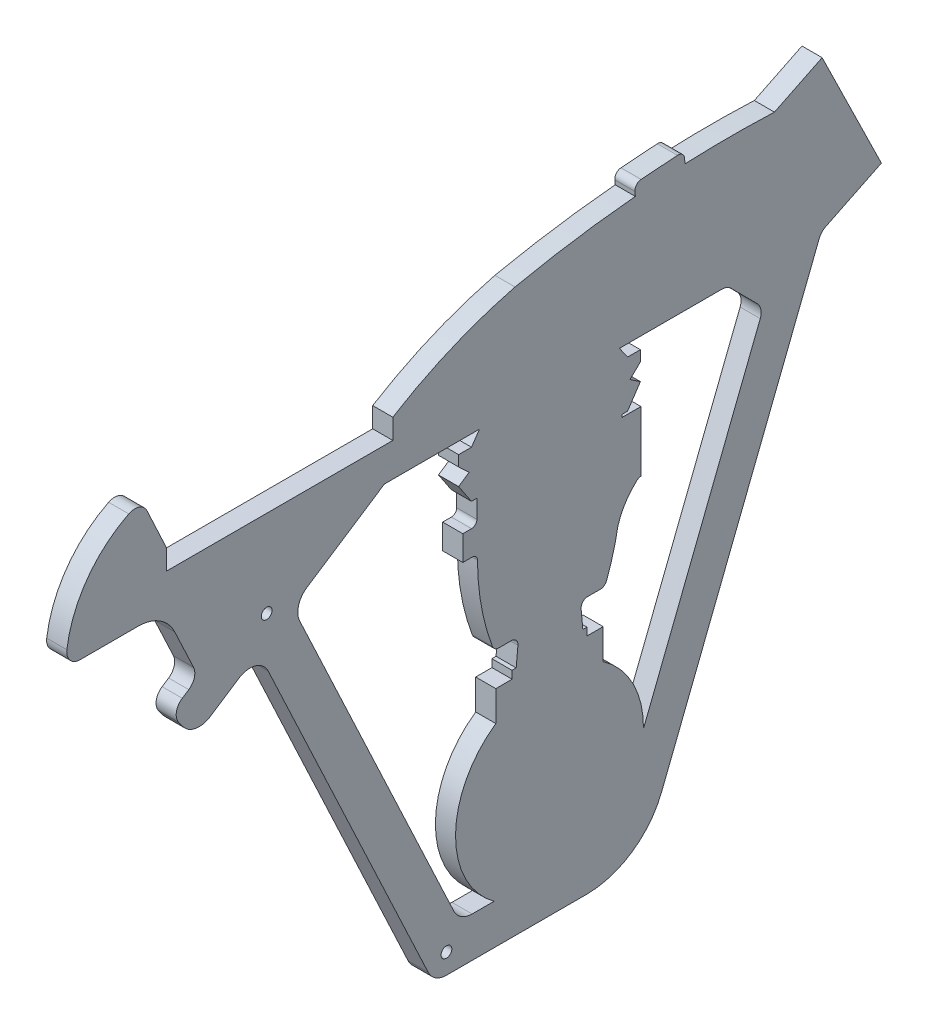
SolidWorks part; units mm, degrees
ref_plane "Alzado" through (0, 0, 0) normal (0, 0, 1) x (1, 0, 0)
ref_plane "Planta" through (0, 0, 0) normal (0, 1, 0) x (1, 0, 0)
ref_plane "Vista lateral" through (0, 0, 0) normal (1, 0, 0) x (0, 0, -1)
sketch "Croquis1" plane through (0, 0, 0) normal (1, 0, 0) x (0, 0, -1)
  line L0 (13667.9983, 5369.9869) -> (13690.858, 5384.9869)
  line L1 (13615.9773, 5299.97) -> (13684.5821, 5344.9869)
  line L2 (13615.9773, 5299.97) -> (13740.3667, 5034.9869)
  line L3 (13667.6771, 5119.2363) -> (13721.3084, 5004.9869)
  line L4 (13721.3084, 5004.9869) -> (13754.4494, 5004.9869)
  line L5 (13577.2438, 5124.9869) -> (13658.6248, 5124.9869)
  line L6 (13524.9162, 5369.9869) -> (13667.9983, 5369.9869)
  line L7 (13522.2981, 5384.9869) -> (13522.2981, 5369.9869)
  line L8 (13524.9162, 5369.9869) -> (13522.2981, 5369.9869)
  line L9 (13447.2981, 5344.9869) -> (13501.2421, 5344.9869)
  line L10 (13522.2981, 5384.9869) -> (13503.6357, 5425.0086)
  line L11 (13524.9215, 5276.1032) -> (13546.1095, 5290.0063)
  line L12 (13942.9288, 5342.0265) -> (13962.3593, 5322.4223)
  line L13 (14008.4696, 5341.3669) -> (13891.049, 5043.0137)
  line L14 (13964.5621, 5311.7205) -> (13877.5726, 5090.6894)
  line L15 (13754.4494, 5004.9869) -> (13835.2174, 5004.9869)
  line L16 (13740.3667, 5034.9869) -> (13766.3054, 5034.9869)
  line L17 (13684.5821, 5344.9869) -> (13755.4522, 5344.9869)
  line L18 (13859.703, 5344.9869) -> (13935.8264, 5344.9869)
  line L19 (13528.3988, 5327.735) -> (13546.1095, 5290.0063)
  line L20 (13875.8064, 5445.9012) -> (13902.9105, 5447.8818)
  line L21 (13975.13, 5439.6545) -> (14037.5829, 5470.2464)
  line L22 (14037.5829, 5470.2464) -> (14081.7674, 5380.0446)
  line L23 (14081.7674, 5380.0446) -> (14013.3909, 5346.6925)
  line L24 (13871.1919, 5440.4559) -> (13871.5029, 5437.0801)
  line L25 (13908.27, 5443.1152) -> (13908.4253, 5439.5925)
  line L26 (13847.5776, 5171.5255) -> (13835.4535, 5171.5255)
  line L27 (13779.7017, 5171.5255) -> (13767.5776, 5171.5255)
  line L28 (13767.5776, 5171.5255) -> (13767.5776, 5148.9711)
  line L29 (13847.5776, 5171.5255) -> (13847.5776, 5148.9711)
  line L30 (13743.0012, 5283.7615) -> (13749.4823, 5283.7615)
  line L31 (13753.4823, 5287.7615) -> (13753.4823, 5301.4231)
  line L32 (13749.4361, 5301.4231) -> (13739.8671, 5315.7235)
  line L33 (13739.8671, 5315.7235) -> (13747.684, 5320.9768)
  line L34 (13747.684, 5320.9768) -> (13739.8671, 5328.3853)
  line L35 (13739.8671, 5328.3853) -> (13739.8671, 5336.3326)
  line L36 (13739.8671, 5336.3326) -> (13749.4361, 5336.3326)
  line L37 (13779.0681, 5196.6733) -> (13769.771, 5196.6733)
  line L38 (13741.3273, 5336.3326) -> (13749.4361, 5336.3326)
  line L39 (13749.4361, 5336.3326) -> (13755.4522, 5344.9869)
  line L40 (13749.4361, 5301.4231) -> (13753.4823, 5301.4231)
  line L41 (13832.4116, 5177.3224) -> (13835.4535, 5177.259)
  line L42 (13835.4535, 5177.259) -> (13835.4535, 5171.5255)
  line L43 (13784.0462, 5191.2063) -> (13782.7436, 5177.3224)
  line L44 (13782.7436, 5177.3224) -> (13779.7017, 5177.259)
  line L45 (13779.7017, 5177.259) -> (13779.7017, 5171.5255)
  line L46 (13743.0012, 5265.1728) -> (13749.9204, 5265.1728)
  line L47 (13836.0871, 5196.6733) -> (13845.3843, 5196.6733)
  line L48 (13831.109, 5191.2063) -> (13832.4116, 5177.3224)
  line L49 (13861.673, 5294.4672) -> (13890.326, 5294.4672)
  line L50 (13875.9312, 5254.4672) -> (13890.326, 5254.4672)
  line L51 (13861.673, 5294.4672) -> (13861.673, 5301.4231)
  line L52 (13865.7191, 5301.4231) -> (13875.2881, 5315.7235)
  line L53 (13875.2881, 5315.7235) -> (13867.4712, 5320.9768)
  line L54 (13867.4712, 5320.9768) -> (13875.2881, 5328.3853)
  line L55 (13875.2881, 5328.3853) -> (13875.2881, 5336.3326)
  line L56 (13875.2881, 5336.3326) -> (13865.7191, 5336.3326)
  line L57 (13873.8279, 5336.3326) -> (13865.7191, 5336.3326)
  line L58 (13865.7191, 5336.3326) -> (13859.703, 5344.9869)
  line L59 (13865.7191, 5301.4231) -> (13861.673, 5301.4231)
  line L60 (13743.0012, 5283.7615) -> (13743.0012, 5265.1728)
  arc A0 (13667.6771, 5119.2363) -> (13658.6248, 5124.9869) centre (13658.6248, 5114.9869) ccw
  arc A1 (13577.2438, 5124.9869) -> (13524.9215, 5276.1032) centre (13347.2981, 5129.9869) ccw
  arc A2 (13503.6357, 5425.0086) -> (13447.2981, 5344.9869) centre (13532.2981, 5344.9869) ccw
  arc A3 (13942.9288, 5342.0265) -> (13935.8264, 5344.9869) centre (13935.8264, 5334.9869) ccw
  arc A4 (14013.3909, 5346.6925) -> (14008.4696, 5341.3669) centre (14017.7749, 5337.7047) ccw
  arc A5 (13964.5621, 5311.7205) -> (13962.3593, 5322.4223) centre (13955.2569, 5315.3828) ccw
  arc A6 (13835.2174, 5004.9869) -> (13891.049, 5043.0137) centre (13835.2174, 5064.9869) ccw
  arc A7 (13528.3988, 5327.735) -> (13501.2421, 5344.9869) centre (13501.2421, 5314.9869) ccw
  arc A8 (13781.8639, 5423.4908) -> (13690.858, 5384.9869) centre (13862.0741, 5107.1094) ccw
  arc A9 (13975.13, 5439.6545) -> (13908.4253, 5439.5925) centre (13942.4955, 4666.352) ccw
  arc A10 (13871.5029, 5437.0801) -> (13781.8639, 5423.4908) centre (13942.4955, 4666.352) ccw
  arc A11 (13875.8064, 5445.9012) -> (13871.1919, 5440.4559) centre (13876.1708, 5440.9145) ccw
  arc A12 (13908.27, 5443.1152) -> (13902.9105, 5447.8818) centre (13903.2749, 5442.8951) ccw
  arc A13 (13767.5776, 5148.9711) -> (13766.3054, 5034.9869) centre (13807.5776, 5091.5255) ccw
  arc A14 (13877.5726, 5090.6894) -> (13847.5776, 5148.9711) centre (13807.5776, 5091.5255) ccw
  arc A15 (13753.9204, 5261.1806) -> (13765.0892, 5199.9179) centre (13929.3821, 5261.5197) ccw
  arc A16 (13753.9204, 5261.1806) -> (13749.9204, 5265.1728) centre (13749.9204, 5261.1728) ccw
  arc A17 (13765.0892, 5199.9179) -> (13769.771, 5196.6733) centre (13769.771, 5201.6733) ccw
  arc A18 (13749.4823, 5283.7615) -> (13753.4823, 5287.7615) centre (13749.4823, 5287.7615) ccw
  arc A19 (13784.0462, 5191.2063) -> (13779.0681, 5196.6733) centre (13779.0681, 5191.6733) ccw
  arc A20 (13872.583, 5253.1806) -> (13858.5855, 5231.1419) centre (13905.2105, 5216.9934) ccw
  arc A21 (13875.9312, 5254.4672) -> (13872.583, 5253.1806) centre (13875.9312, 5249.4672) ccw
  arc A22 (13850.066, 5199.9179) -> (13858.5855, 5231.1419) centre (13685.7732, 5261.5197) ccw
  arc A23 (13845.3843, 5196.6733) -> (13850.066, 5199.9179) centre (13845.3843, 5201.6733) ccw
  arc A24 (13836.0871, 5196.6733) -> (13831.109, 5191.2063) centre (13836.0871, 5191.6733) ccw
  arc A25 (13895.0386, 5257.7964) -> (13895.0386, 5291.138) centre (13848.0178, 5274.4672) ccw
  arc A26 (13895.0386, 5291.138) -> (13890.326, 5294.4672) centre (13890.326, 5289.4672) ccw
  arc A27 (13890.326, 5254.4672) -> (13895.0386, 5257.7964) centre (13890.326, 5259.4672) ccw
extrude "Saliente-Extruir1" add sketch "Croquis1" along normal blind 15 contours L25 A12 L20 A11 L24 A10 A8 L0 L6 L8 L7 L10 A2 L9 A7 L19 L11 A1 L5 A0 L3 L4 L15 A6 L13 A4 L23 L22 L21 A9 A19 L43 L44 L45 L27 L28 A13 L16 L2 L1 L17 L39 L36 L35 L34 L33 L32 L40 L31
sketch "Croquis2" plane through (15, 0, 0) normal (1, 0, 0) x (0, 0, -1)
  line L0 (13667.6771, 5119.2363) -> (13590.6406, 5283.3447)
  line L3 (13667.6771, 5119.2363) -> (13721.3084, 5004.9869) construction
  line L4 (13577.2438, 5124.9869) -> (13658.6248, 5124.9869) construction
  line L5 (13577.2438, 5124.9869) -> (13658.6248, 5124.9869)
  line L6 (13590.6406, 5283.3447) -> (13542.4428, 5251.7184)
  line L7 (13615.9773, 5299.97) -> (13684.5821, 5344.9869) construction
  arc A0 (13667.6771, 5119.2363) -> (13658.6248, 5124.9869) centre (13658.6248, 5114.9869) ccw construction
  arc A1 (13577.2438, 5124.9869) -> (13524.9215, 5276.1032) centre (13347.2981, 5129.9869) ccw construction
  arc A2 (13667.6771, 5119.2363) -> (13658.6248, 5124.9869) centre (13658.6248, 5114.9869) ccw
  arc A3 (13577.2438, 5124.9869) -> (13542.4428, 5251.7184) centre (13347.2981, 5129.9869) ccw
extrude "Cortar-Extruir2" cut sketch "Croquis2" against normal blind 77
fillet "Redondeo1" radius 15 3 edges at (7.5, 5004.9869, -13721.3084) (7.5, 5034.9869, -13740.3667) (7.5, 5299.97, -13615.9773)
fillet "Redondeo2" radius 15 1 edges at (7.5, 5283.3447, -13590.6406)
sketch "Croquis3" plane through (15, 0, 0) normal (1, 0, 0) x (0, 0, -1)
  circle A0 centre (13730.8376, 5019.9869) radius 4
  dimension "D1" = 8
extrude "Cortar-Extruir3" cut sketch "Croquis3" against normal through all
fillet "Redondeo3" radius 15 1 edges at (7.5, 5251.7184, -13542.4428)
fillet "Redondeo4" radius 10 2 edges at (7.5, 5290.0063, -13546.1095) (7.5, 5276.1032, -13524.9215)
fillet "Redondeo5" radius 10 1 edges at (7.5, 5344.9869, -13447.2981)
fillet "Redondeo6" radius 10 1 edges at (7.5, 5425.0086, -13503.6357)
sketch "Croquis4" plane through (15, 0, 0) normal (1, 0, 0) x (0, 0, -1)
  line L0 (13667.9983, 5369.9869) -> (13690.858, 5369.9869)
  line L1 (13690.858, 5369.9869) -> (13690.858, 5384.9869)
  line L2 (13690.858, 5384.9869) -> (13667.9983, 5384.9869)
  line L3 (13667.9983, 5369.9869) -> (13667.9983, 5384.9869)
  dimension "D1" = 15
extrude "Cortar-Extruir4" cut sketch "Croquis4" against normal through all
sketch "Croquis5" plane through (15, 0, 0) normal (1, 0, 0) x (0, 0, -1)
  line L0 (14037.5829, 5470.2464) -> (14081.7674, 5380.0446)
  line L1 (14037.5829, 5470.2464) -> (14010.6415, 5457.0494)
  line L2 (14081.7674, 5380.0446) -> (14054.826, 5366.8476)
  line L3 (14010.6415, 5457.0494) -> (14054.826, 5366.8476)
  dimension "D1" = 30
extrude "Cortar-Extruir5" cut sketch "Croquis5" against normal through all
sketch "Croquis6" plane through (15, 0, 0) normal (1, 0, 0) x (0, 0, -1)
  line L0 (13861.673, 5294.4672) -> (13890.326, 5294.4672) construction
  line L1 (13875.673, 5294.4672) -> (13925.188, 5294.4672)
  line L2 (13875.673, 5294.4672) -> (13875.673, 5233.9887)
  line L3 (13875.673, 5233.9887) -> (13925.188, 5233.9887)
  line L4 (13925.188, 5294.4672) -> (13925.188, 5233.9887)
  line L6 (13861.673, 5294.4672) -> (13861.673, 5301.4231) construction
  dimension "D1" = 14
extrude "Cortar-Extruir6" cut sketch "Croquis6" against normal through all
sketch "Croquis7" plane through (15, 0, 0) normal (1, 0, 0) x (0, 0, -1)
  line L0 (13861.673, 5294.4672) -> (13861.673, 5301.4231) construction
  line L1 (13861.673, 5299.4672) -> (13875.673, 5299.4672)
  line L2 (13861.673, 5299.4672) -> (13861.673, 5294.4672)
  line L3 (13861.673, 5294.4672) -> (13875.673, 5294.4672)
  line L4 (13875.673, 5299.4672) -> (13875.673, 5294.4672)
  dimension "D1" = 5
extrude "Saliente-Extruir2" add sketch "Croquis7" against normal blind 15
sketch "Croquis8" plane through (15, 0, 0) normal (1, 0, 0) x (0, 0, -1)
  line L0 (13655.7186, 5326.0473) -> (13565.5276, 5266.8661) construction
  line L1 (13626.855, 5307.1077) -> (13684.5821, 5344.9869) construction
  line L2 (13576.1818, 5273.8571) -> (13554.8735, 5259.8751) construction
  line L3 (13589.7453, 5320.5516) -> (13645.9104, 5200.9048) construction
  line L4 (13552.7355, 5276.4131) -> (13638.5218, 5332.7041) construction
  line L5 (13621.5059, 5288.1926) -> (13736.3174, 5043.6129) construction
  circle A0 centre (13596.8703, 5305.3734) radius 4
  dimension "D3" = 8
  dimension "D1" = 15
  dimension "D2" = 15
extrude "Cortar-Extruir7" cut sketch "Croquis8" against normal through all
